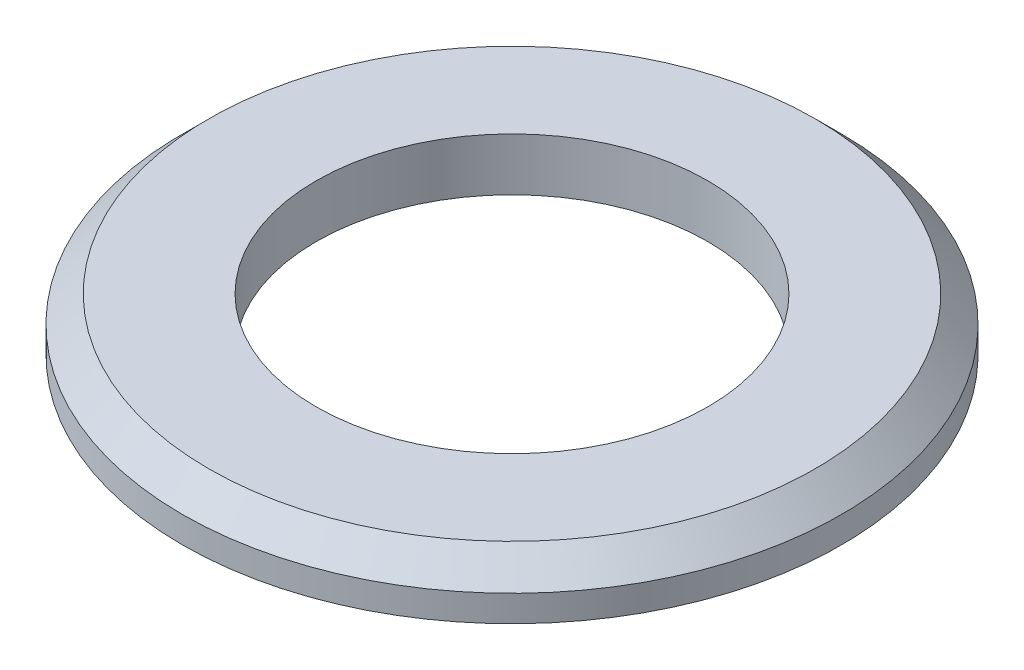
SolidWorks part; units mm, degrees
ref_plane "Front" through (0, 0, 0) normal (0, 0, 1) x (1, 0, 0)
ref_plane "Top" through (0, 0, 0) normal (0, 1, 0) x (1, 0, 0)
ref_plane "Right" through (0, 0, 0) normal (1, 0, 0) x (0, 0, -1)
sketch "Sketch1" plane through (0, 0, 0) normal (0, 1, 0) x (1, 0, 0)
  circle A0 centre (0, 0) radius 52
  circle A1 centre (0, 0) radius 87.5
extrude "Extrude1" add sketch "Sketch1" along normal blind 14
chamfer "Chamfer1" distance 7 1 edges at (0, 14, 87.5)
